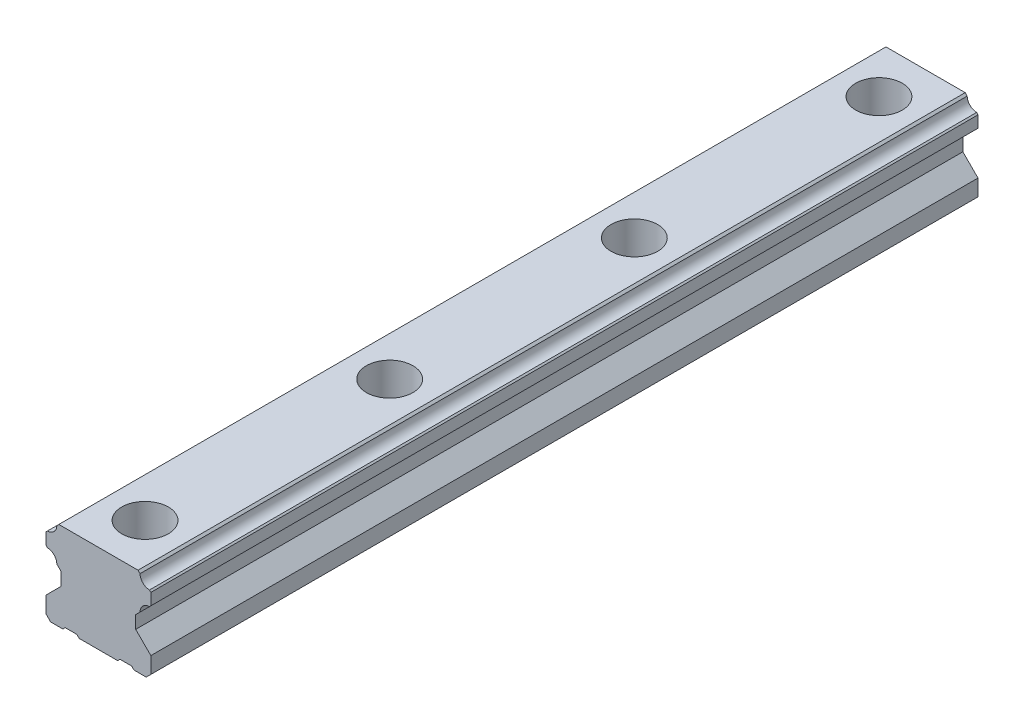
SolidWorks part; units mm, degrees
ref_plane "Front Plane" through (0, 0, 0) normal (0, 0, 1) x (1, 0, 0)
ref_plane "Top Plane" through (0, 0, 0) normal (0, 1, 0) x (1, 0, 0)
ref_plane "Right Plane" through (0, 0, 0) normal (1, 0, 0) x (0, 0, -1)
sketch "Sketch1" plane through (0, 0, 0) normal (0, 0, 1) x (1, 0, 0)
  line L0 (-17.8596, 37.1411) -> (-17.0006, 38)
  line L1 (-22.5, 32.5006) -> (-21.9078, 33.0928)
  line L2 (-22.5, 32.5006) -> (-22.5, 27.4979)
  line L3 (-21.9103, 26.9082) -> (-22.5, 27.4979)
  line L4 (-17.8595, 22.8575) -> (-16, 20.9979)
  line L5 (-16, 20.9979) -> (-16, 15.5008)
  line L6 (-16, 15.5008) -> (-22.5, 9.0008)
  line L7 (-22.5, 9.0008) -> (-22.5, 2)
  line L8 (-22.5, 2) -> (-20.5, 0)
  line L9 (-20.5, 0) -> (-15.25, 0)
  line L10 (-14.25, 1) -> (-15.25, 0)
  line L11 (-14.25, 1) -> (-9.25, 1)
  line L12 (-8.25, 0) -> (-9.25, 1)
  line L13 (-8.25, 0) -> (8.25, 0)
  line L14 (9.25, 1) -> (8.25, 0)
  line L15 (9.25, 1) -> (14.25, 1)
  line L16 (15.25, 0) -> (14.25, 1)
  line L17 (15.25, 0) -> (20.5, 0)
  line L18 (20.5, 0) -> (22.5, 2)
  line L19 (22.5, 2) -> (22.5, 9.0008)
  line L20 (22.5, 9.0008) -> (16, 15.5008)
  line L21 (16, 15.5008) -> (16, 20.9979)
  line L22 (16, 20.9979) -> (17.8595, 22.8575)
  line L23 (22.5, 27.4979) -> (21.9103, 26.9082)
  line L24 (22.5, 27.4979) -> (22.5, 32.5006)
  line L25 (21.9078, 33.0928) -> (22.5, 32.5006)
  line L26 (17.0006, 38) -> (17.8596, 37.1411)
  line L27 (-17.0006, 38) -> (17.0006, 38)
  arc A0 (-21.9078, 33.0928) -> (-17.8596, 37.1411) centre (-21.9888, 37.222) ccw
  arc A1 (-17.8595, 22.8575) -> (-21.9103, 26.9082) centre (-21.9888, 22.779) ccw
  arc A2 (21.9103, 26.9082) -> (17.8595, 22.8575) centre (21.9888, 22.779) ccw
  arc A3 (17.8596, 37.1411) -> (21.9078, 33.0928) centre (21.9888, 37.222) ccw
extrude "Boss-Extrude1" add sketch "Sketch1" along normal mid plane 355
hole_wizard "CBORE for M4 Hex Socket Head Cap Screw1" positions "Sketch2" profile "Sketch3" counterbore size "M4" standard "DIN"
sketch "Sketch2" plane through (0, 38, 0) normal (0, 1, 0) x (1, 0, 0)
  line L0 (17.0006, -177.5) -> (-17.0006, -177.5) construction
  point P0 (0, -157.5)
  dimension "D1" = 20
sketch "Sketch3" plane through (0, 38, 157.5) normal (1, 0, 0) x (0, 0, 1)
  line L0 (0, 0) -> (0, 38)
  line L1 (0, 38) -> (7, 38)
  line L3 (7, 38) -> (7, 17)
  line L4 (7, 17) -> (10, 17)
  line L5 (10, 17) -> (10, 0)
  line L7 (10, 0) -> (0, 0)
  line L11 (0, -6.35) -> (0, 107.95) construction
  dimension "Thru Hole Dia." = 14
  dimension "Thru Hole Depth" = 38
  dimension "C'Bore Dia." = 20
  dimension "C'Bore Depth" = 17
pattern_linear "LPattern1" count 4 spacing 105 along (0, 0, -1) of "CBORE for M4 Hex Socket Head Cap Screw1"
